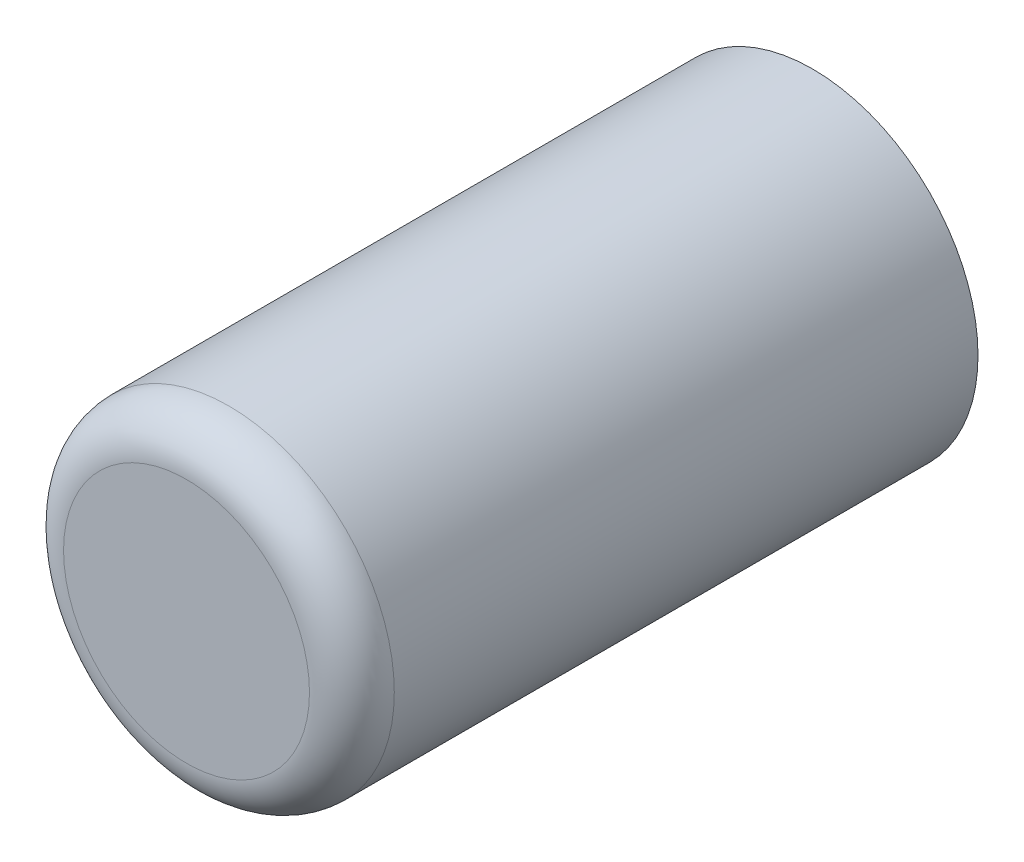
SolidWorks part; units mm, degrees
ref_plane "Front Plane" through (0, 0, 0) normal (0, 0, 1) x (1, 0, 0)
ref_plane "Top Plane" through (0, 0, 0) normal (0, 1, 0) x (1, 0, 0)
ref_plane "Right Plane" through (0, 0, 0) normal (1, 0, 0) x (0, 0, -1)
sketch "Sketch1" plane through (0, 0, 0) normal (0, 0, 1) x (1, 0, 0)
  circle A0 centre (-22.5, 239.5193) radius 11.6969
extrude "Boss-Extrude1" add sketch "Sketch1" along normal blind 44.2869
fillet "Fillet1" radius 3 1 edges at (-10.8031, 239.5193, 44.2869)
